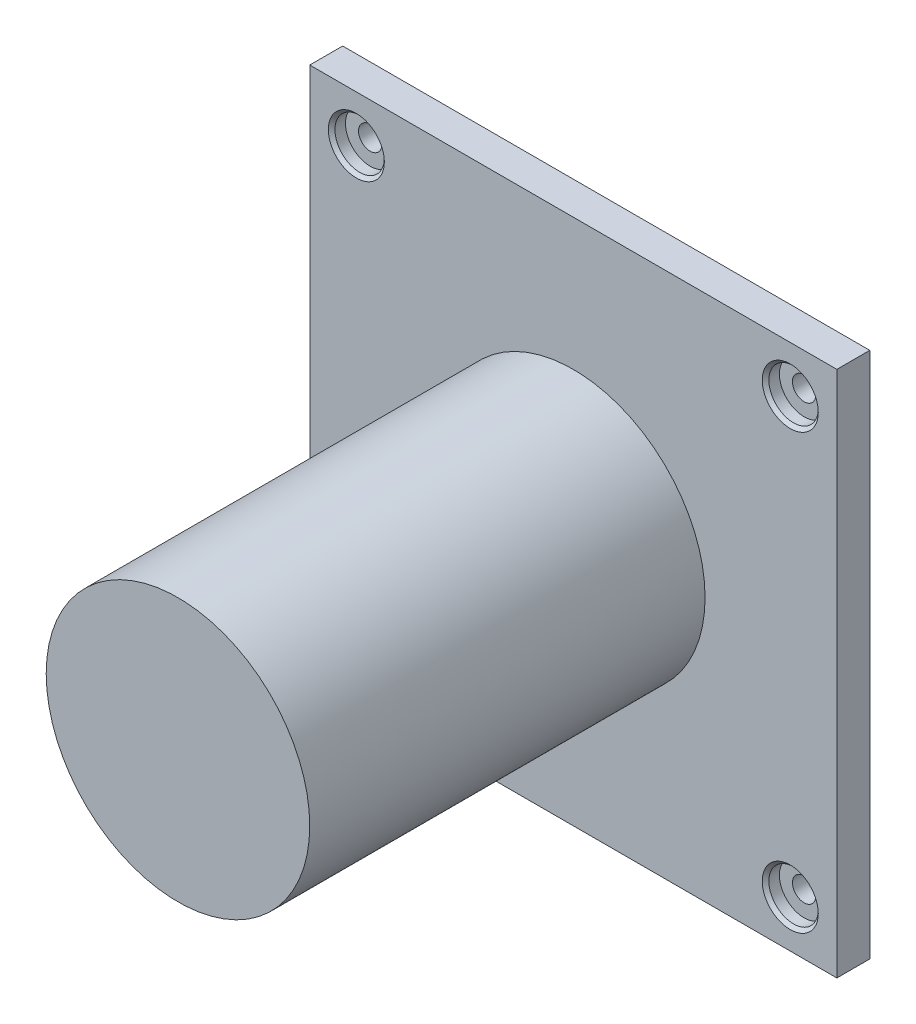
SolidWorks part; units mm, degrees
ref_plane "Front Plane" through (0, 0, 0) normal (0, 0, 1) x (1, 0, 0)
ref_plane "Top Plane" through (0, 0, 0) normal (0, 1, 0) x (1, 0, 0)
ref_plane "Right Plane" through (0, 0, 0) normal (1, 0, 0) x (0, 0, -1)
sketch "Sketch2" plane through (0, 0, 0) normal (0, 0, 1) x (1, 0, 0)
  line L1 (0, 0) -> (101.6, 0)
  line L2 (0, 0) -> (0, 101.6)
  line L3 (0, 101.6) -> (101.6, 101.6)
  line L4 (101.6, 0) -> (101.6, 101.6)
  dimension "D1" = 101.6
  dimension "D2" = 101.6
extrude "Boss-Extrude1" add sketch "Sketch2" along normal blind 6.35
sketch "Sketch3" plane through (0, 0, 6.35) normal (0, 0, 1) x (1, 0, 0)
  circle A0 centre (50.8, 50.8) radius 25.4
  dimension "D1" = 50.8
extrude "Boss-Extrude2" add sketch "Sketch3" along normal blind 76.2
sketch "Sketch4" plane through (0, 0, 6.35) normal (0, 0, 1) x (1, 0, 0)
  line L0 (0, 101.6) -> (8.9803, 92.6197)
  line L1 (101.6, 101.6) -> (92.6197, 92.6197)
  line L2 (0, 0) -> (8.9803, 8.9803)
  line L3 (101.6, 0) -> (92.6197, 8.9803)
  line L4 (0, 0) -> (101.6, 0) construction
  line L5 (101.6, 101.6) -> (0, 101.6) construction
  point P1 (8.9803, 92.6197)
  point P4 (92.6197, 92.6197)
  point P7 (8.9803, 8.9803)
  point P10 (92.6197, 8.9803)
  dimension "D1" = 45
  dimension "D2" = 45
  dimension "D3" = 45
  dimension "D4" = 45
  dimension "D5" = 12.7
  dimension "D6" = 12.7
hole_wizard "CBORE for #8 Binding Head Machine Screw1" positions "Sketch4" profile "Sketch5" counterbore size "#8" standard "ANSI Inch"
sketch "Sketch5" plane through (92.6197, 8.9803, 6.35) normal (1, 0, 0) x (0, -1, 0)
  line L0 (0, 0) -> (0, 6.35)
  line L1 (0, 6.35) -> (2.2479, 6.35)
  line L3 (2.2479, 6.35) -> (2.2479, 2.667)
  line L4 (4.7625, 2.667) -> (2.2479, 2.667)
  line L5 (4.7625, 2.667) -> (4.7625, 0.635)
  line L6 (4.7625, 0.635) -> (5.3975, 0)
  line L7 (5.3975, 0) -> (0, 0)
  line L8 (-4.7625, 0.635) -> (-5.3975, 0) construction
  line L11 (0, -6.35) -> (0, 107.95) construction
  dimension "Thru Hole Dia." = 4.4958
  dimension "Thru Hole Depth" = 6.35
  dimension "C'Bore Dia." = 9.525
  dimension "C'Bore Depth" = 2.667
  dimension "Near C'Sink Dia." = 10.795
  dimension "Near C'Sink Angle" = 90
